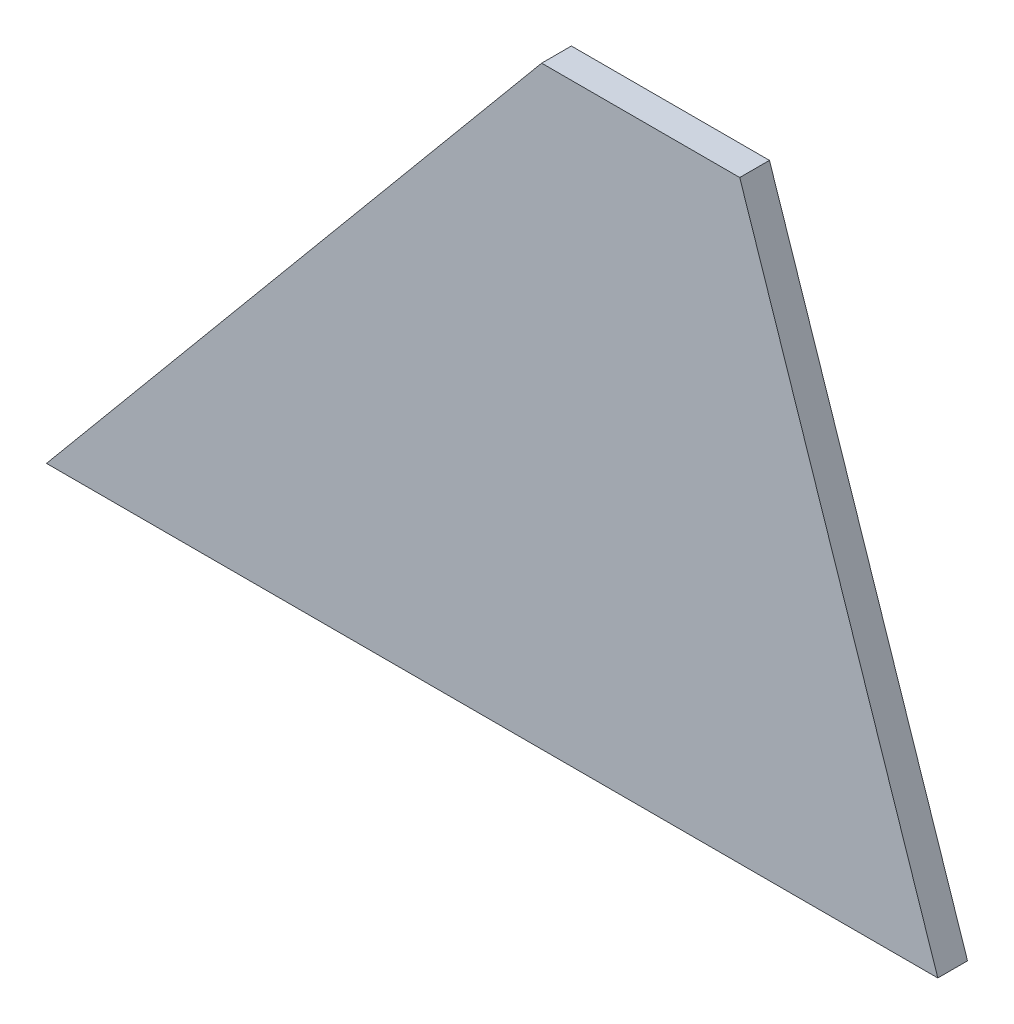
SolidWorks part; units mm, degrees
ref_plane "Front Plane" through (0, 0, 0) normal (0, 0, 1) x (1, 0, 0)
ref_plane "Top Plane" through (0, 0, 0) normal (0, 1, 0) x (1, 0, 0)
ref_plane "Right Plane" through (0, 0, 0) normal (1, 0, 0) x (0, 0, -1)
sketch "Sketch4" plane through (0, 0, 0) normal (0, 0, 1) x (1, 0, 0)
  line L6 (107.3385, 111.154) -> (18.4385, 111.154)
  line L8 (107.3385, 111.154) -> (132.7385, 111.154)
  line L12 (18.4385, 111.154) -> (81.9385, 187.354)
  line L13 (81.9385, 187.354) -> (107.3385, 187.354)
  line L14 (132.7385, 111.154) -> (107.3385, 187.354)
extrude "Extrude1" add sketch "Sketch4" along normal blind 3.81
ref_plane "Plane1" through (18.4385, 111.154, 3.81) normal (-0.6402, -0.7682, 0) x (0.7682, -0.6402, 0)
sketch "Sketch6" plane through (0, 0, 3.81) normal (0, 0, 1) x (1, 0, 0)
  line L0 (107.3385, 187.354) -> (122.0642, 187.354)
  line L1 (132.7385, 111.154) -> (147.4642, 111.154)
  line L2 (63.7537, 187.354) -> (0.2537, 111.154)
  line L3 (18.4385, 111.154) -> (0.2537, 111.154)
  line L4 (122.0642, 187.354) -> (147.4642, 111.154)
  line L10 (81.9385, 187.354) -> (63.7537, 187.354)
